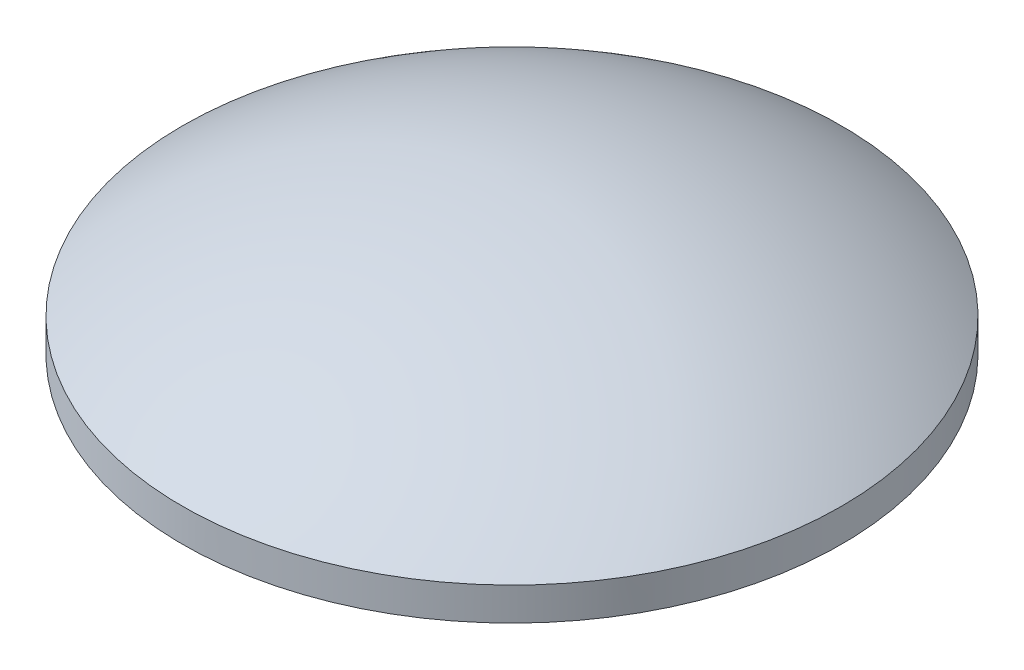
SolidWorks part; units mm, degrees
ref_plane "Plan1" through (0, 0, 0) normal (0, 0, 1) x (1, 0, 0)
ref_plane "Plan2" through (0, 0, 0) normal (0, 1, 0) x (1, 0, 0)
ref_plane "Plan3" through (0, 0, 0) normal (1, 0, 0) x (0, 0, -1)
sketch "Esquisse1" plane through (0, 0, 0) normal (0, 0, 1) x (1, 0, 0)
  line L0 (-12, 70) -> (-12, -100) construction
  line L1 (-12, 8) -> (-12, 6)
  line L3 (6, 0) -> (6, -70) construction
  line L4 (-30, 2) -> (-30, 0.2)
  line L5 (-30, 0.2) -> (-29.7302, 0.2)
  arc A0 (-29.7302, 0.2) -> (-12, 6) centre (-12, -24) cw
  arc A1 (-30, 2) -> (-12, 8) centre (-12, -22) cw
  dimension "D3" = 30
  dimension "D4" = 30
  dimension "D2" = 18
revolve "Base-Révolution" add sketch "Esquisse1" angle 360 about L0
